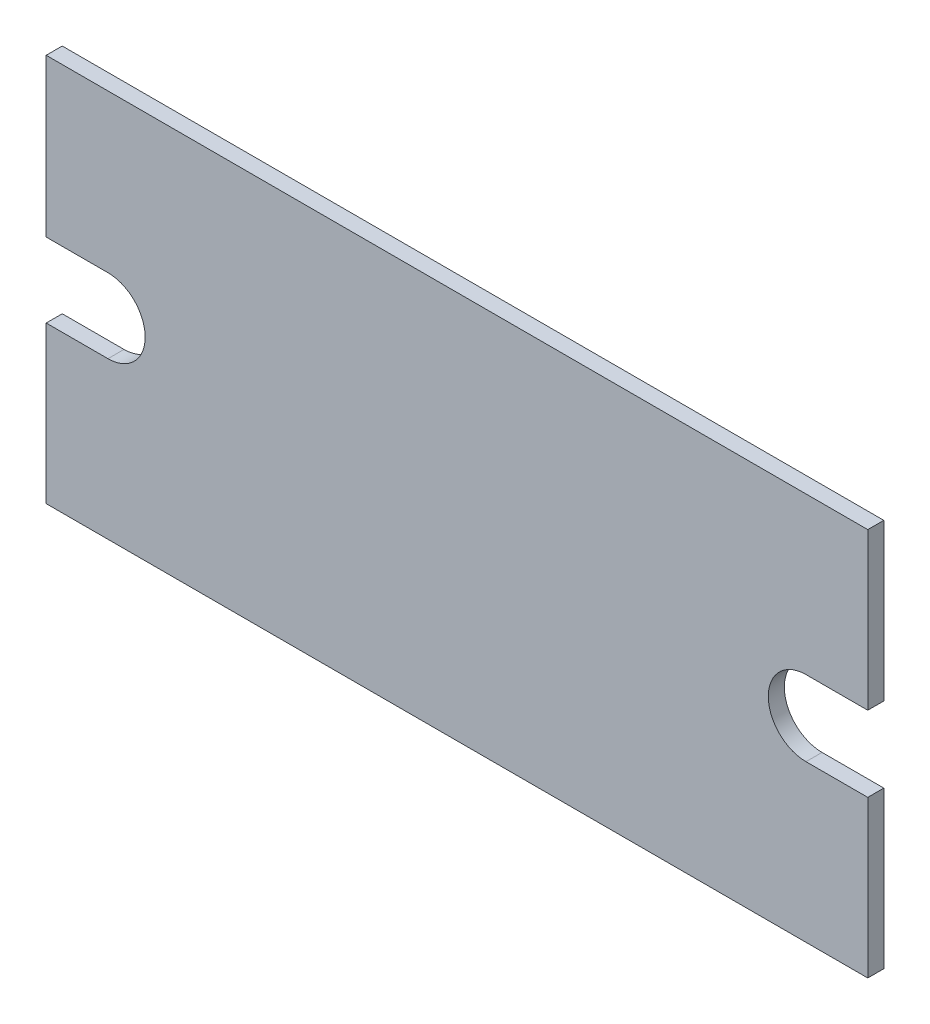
SolidWorks part; units mm, degrees
ref_plane "Přední rovina" through (0, 0, 0) normal (0, 0, 1) x (1, 0, 0)
ref_plane "Horní rovina" through (0, 0, 0) normal (0, 1, 0) x (1, 0, 0)
ref_plane "Pravá rovina" through (0, 0, 0) normal (1, 0, 0) x (0, 0, -1)
sketch "Skica1" plane through (0, 0, 0) normal (0, 0, 1) x (1, 0, 0)
  line L0 (-17.4945, 10.1471) -> (23.9328, 10.1471)
  line L1 (23.9328, 10.1471) -> (23.9328, 0.3971)
  line L2 (-17.4945, 10.1471) -> (-27.2672, 10.1471)
  line L3 (-27.2672, -4.3029) -> (-23.4172, -4.3029)
  line L4 (23.9328, -4.3029) -> (23.9328, -14.0529)
  line L5 (23.9328, -14.0529) -> (-27.2672, -14.0529)
  line L6 (-27.2672, -14.0529) -> (-27.2672, -4.3029)
  line L7 (-27.2672, 0.3358) -> (-23.4172, 0.3358)
  line L8 (23.9328, 0.3971) -> (20.0828, 0.3971)
  line L9 (-27.2672, 0.3358) -> (-27.2672, 10.0858)
  line L10 (23.9328, -4.3029) -> (20.0828, -4.3029)
  line L11 (-27.2672, 10.0858) -> (-27.2672, 10.1471)
  line L12 (20.0828, 0.3971) -> (20.0828, -4.3029) construction
  line L13 (-23.4172, 0.3358) -> (-23.4172, -4.3029) construction
  arc A0 (-23.4172, 0.3358) -> (-23.4172, -4.3029) centre (-23.4172, -1.9836) cw
  arc A1 (20.0828, 0.3971) -> (20.0828, -4.3029) centre (20.0828, -1.9529) ccw
  dimension "D1" = 51.2
  dimension "D2" = 24.2
  dimension "D3" = 9.75
  dimension "D4" = 9.75
  dimension "D5" = 9.75
  dimension "D6" = 3.85
extrude "Přidat vysunutím1" add sketch "Skica1" along normal blind 1
